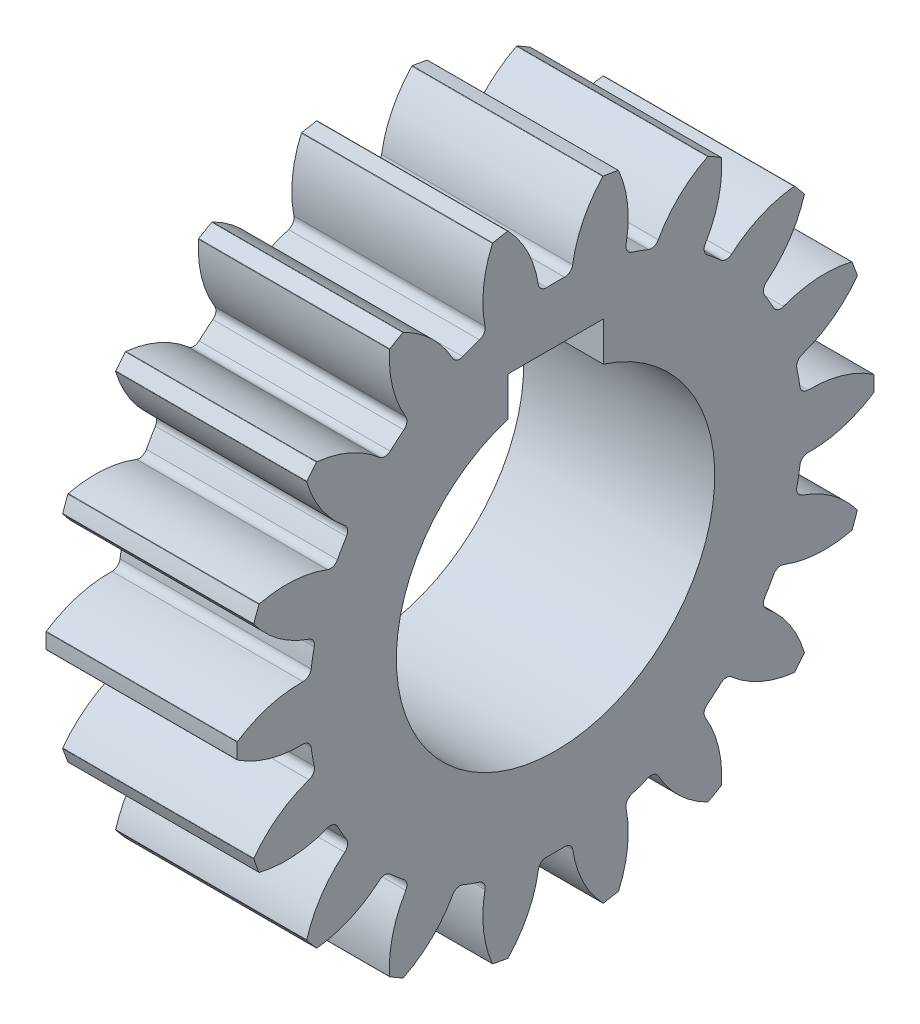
SolidWorks part; units mm, degrees
ref_plane "Plane1" through (0, 0, 0) normal (0, 0, 1) x (1, 0, 0)
ref_plane "Plane2" through (0, 0, 0) normal (0, 1, 0) x (1, 0, 0)
ref_plane "Plane3" through (0, 0, 0) normal (1, 0, 0) x (0, 0, -1)
sketch "HoldingSke" plane through (0, 0, 0) normal (0, 1, 0) x (1, 0, 0)
  line L0 (0, 0) -> (0.9511, -0.309)
  line L1 (-15, 0) -> (100, 0) construction
  line L2 (0, 0) -> (-2.1039, 2.3779)
  line L3 (0, 0) -> (-11.863, 4.5341)
  line L4 (0, 0) -> (8.2133, 2.6687)
  line L5 (0, 0) -> (-46.8476, -17.4728)
  line L6 (0, 0) -> (-4.9738, -3.3558)
  line L7 (-2.1039, 2.3779) -> (8.6586, 51.2059)
  line L8 (-76.2, 54.61) -> (-76.1, 54.61)
  line L9 (-71.009, 38.7566) -> (-53.1078, 45.2721)
  line L10 (-76.2, 71.12) -> (104.1128, 71.12)
  line L11 (0, 0) -> (-6, 0)
  line L12 (-76.2, 101.6) -> (-76.162, 101.6)
  line L13 (24.9733, 27.94) -> (52.9518, 28.4284)
  line L14 (24.9733, 27.94) -> (24.9743, 27.94)
  line L15 (24.9733, 27.94) -> (100.4006, 29.5858)
  line L16 (-63.627, -1) -> (-12.827, -1)
  circle A0 centre (0, 0) radius 0.4
  circle A1 centre (0, 0) radius 7.749
  circle A2 centre (0, 0) radius 37.5
  circle A3 centre (0, 0) radius 0.4
  dimension "MHD" = 15.498
  dimension "Hub_dia" = 75
  dimension "Bore" = 0.8
  dimension "MBD" = 0.8
  dimension "Num_teeth" = 18
  dimension "Pitch_radius" = 180.3128
  dimension "Pitch" = 1
  dimension "Width" = 6
  dimension "Overall_len" = 50
  dimension "Show_teeth" = 18
  dimension "Thickness" = 6
  dimension "OAL" = 50.0001
  dimension "T_dim" = 0.1
  dimension "Ap" = 20
  dimension "H" = 19.05
  dimension "Backlash" = 0.038
  dimension "Addendum_fac" = 1
  dimension "Dedendum_fac" = 1.25
  dimension "Clearance_fac" = 0.25
  dimension "Dedendum_add" = 0.001
  dimension "Module" = 1
sketch "BasProSke" plane through (0, 0, 0) normal (0, 1, 0) x (1, 0, 0)
  line L0 (-10, 0) -> (60, 0) construction
  line L1 (0, 0) -> (0, 10)
  line L2 (0, 0) -> (6, 0)
  line L3 (6, 0) -> (6, 10)
  line L4 (6, 10) -> (0, 10)
  dimension "Diameter" = 20
  dimension "Thickness" = 6
revolve "Base-Revolve" add sketch "BasProSke" angle 360 about L0
sketch "TooCutSke" plane through (0, 0, 0) normal (1, 0, 0) x (0, 0, -1)
  line L1 (0, 0) -> (0, 107) construction
  line L2 (0, 0) -> (-0.8509, 8.9597) construction
  line L3 (0, 0) -> (-3.1157, 17.6701) construction
  line L4 (-0.8509, 8.9597) -> (-1.5579, 8.835) construction
  arc A0 (0.5106, 7.7322) -> (-0.5106, 7.7322) centre (0, 0) ccw
  arc A1 (1.5152, 9.9102) -> (-1.5152, 9.9102) centre (0, 0) ccw
  circle A2 centre (0, 0) radius 9 construction
  circle A3 centre (0, 0) radius 8.4572 construction
  arc A4 (-0.5106, 7.7322) -> (-1.5152, 9.9102) centre (-4.0952, 7.3996) ccw
  arc A5 (1.5152, 9.9102) -> (0.5106, 7.7322) centre (4.0952, 7.3996) ccw
  dimension "Root_dia" = 15.498
  dimension "Overcut_dia" = 20.0508
  dimension "Pitch_dia" = 18
  dimension "Base_dia" = 16.9145
  dimension "Flank_rad" = 3.6
  dimension "Half_ang" = 10
  dimension "Half_CT" = 0.7179
extrude "ToothCut" cut sketch "TooCutSke" along normal through all
fillet "Breaks" radius 0.02 2 edges at (3, 9.8878, -1.4936) (3, 9.8878, 1.4936)
fillet "RootFillets" radius 0.251 2 edges at (3, 7.7322, -0.5106) (3, 7.7322, 0.5106)
pattern_circular "TeethCuts" count 18 every 20 about axis through (-10, 0, 0) along (1, 0, 0) of "ToothCut", "RootFillets", "Breaks"
sketch "HubNeaOneSke" plane through (0, 0, 0) normal (-1, 0, 0) x (0, 0, 1)
  circle A0 centre (0, 0) radius 7.749
  dimension "Diameter" = 15.498
extrude "HubNearOne" [suppressed] add sketch "HubNeaOneSke" along normal blind 44.0001
sketch "HubNeaBotSke" plane through (0, 0, 0) normal (-1, 0, 0) x (0, 0, 1)
  circle A0 centre (0, 0) radius 7.749
  dimension "Diameter" = 15.498
extrude "HubNearBoth" [suppressed] add sketch "HubNeaBotSke" along normal blind 22
ref_plane "FarPln" through (6, 0, 0) normal (1, 0, 0) x (0, 0, -1)
sketch "HubFarSke" plane through (6, 0, 0) normal (1, 0, 0) x (0, 0, -1)
  circle A0 centre (0, 0) radius 7.749
  dimension "Diameter" = 15.498
extrude "HubFar" [suppressed] add sketch "HubFarSke" along normal blind 22
sketch "BorSke" plane through (0, 0, 0) normal (1, 0, 0) x (0, 0, -1)
  circle A0 centre (0, 0) radius 0.4
  dimension "Diameter" = 0.8
extrude "Bore" cut sketch "BorSke" along normal mid plane 100.0001
sketch "KeySke" plane through (0, 0, 0) normal (1, 0, 0) x (0, 0, -1)
  line L0 (-0.05, 0) -> (-0.05, 0.5)
  line L1 (-0.05, 0.5) -> (0.05, 0.5)
  line L2 (0.05, 0.5) -> (0.05, 0)
  line L3 (0, 0) -> (0, 34) construction
  line L4 (-0.05, 0) -> (0.05, 0)
  dimension "Offset" = 0.5
  dimension "Width" = 0.1
extrude "Keyway" [suppressed] cut sketch "KeySke" along normal mid plane 100.0001
pattern_circular "Keyway2" [suppressed] count 2 every 90 about axis through (-10, 0, 0) along (1, 0, 0)
sketch "草图2" plane through (0, 0, 0) normal (-1, 0, 0) x (0, 0, 1)
  line L0 (1.5, 6) -> (-1.5, 6)
  line L1 (-1.5, 4.7697) -> (-1.5, 6)
  line L2 (1.5, 6) -> (1.5, 4.7697)
  arc A0 (-1.5, 4.7697) -> (1.5, 4.7697) centre (0, 0) ccw
extrude "切除-拉伸1" cut sketch "草图2" against normal through all
equation "' \"Module@HoldingSke\" = 6.35"
equation "' \"Num_teeth@HoldingSke\" = 12"
equation "' \"Ap@HoldingSke\" =  20"
equation "' \"Width@HoldingSke\" = 0.5 * 25.4"
equation "' \"Hub_dia@HoldingSke\"= 1 * 25.4"
equation "' \"Overall_len@HoldingSke\" = 1.0 * 25.4"
equation "' \"Bore@HoldingSke\" = 0.75 * 25.4"
equation "' \"T_dim@HoldingSke\" = 0.1 * 25.4"
equation "' \"Width@KeySke\" = 0.25 * 25.4"
equation "' \"Show_teeth@HoldingSke\" = 13"
equation "' \"Backlash@HoldingSke\" = 0.009 * 25.4"
equation "' \"Addendum_fac@HoldingSke\" = 1.0"
equation "' \"Dedendum_fac@HoldingSke\" = 1.25"
equation "' \"Dedendum_add@HoldingSke\" = 0.00005 * 25.4"
equation "' \"Clearance_fac@HoldingSke\" = 0.25"
equation "\"Pitch@HoldingSke\" = 1 / \"Module@HoldingSke\""
equation "\"Overcut_dia@TooCutSke\" = (\"Num_teeth@HoldingSke\" + 2 * \"Addendum_fac@HoldingSke\") / \"Pitch@HoldingSke\" + 0.002 * 25.4"
equation "\"Pitch_dia@TooCutSke\" = \"Num_teeth@HoldingSke\" / \"Pitch@HoldingSke\""
equation "\"Base_dia@TooCutSke\" = \"Num_teeth@HoldingSke\" / \"Pitch@HoldingSke\" * cos((\"Ap@HoldingSke\"  * 3.14159265 / 180))"
equation "\"Root_dia@TooCutSke\" = (\"Num_teeth@HoldingSke\" + 2) / \"Pitch@HoldingSke\" - 2 * (\"Addendum_fac@HoldingSke\" + \"Dedendum_fac@HoldingSke\") / \"Pitch@HoldingSke\" - \"Dedendum_add@HoldingSke\" * 2"
equation "\"Half_ang@TooCutSke\" = 180 / \"Num_teeth@HoldingSke\""
equation "\"Half_CT@TooCutSke\" = \"Num_teeth@HoldingSke\" / \"Pitch@HoldingSke\" * sin((3.14159265 / 2 / \"Num_teeth@HoldingSke\")) / 2 - 7 * \"Backlash@HoldingSke\" / 4"
equation "\"Flank_rad@TooCutSke\" = \"Num_teeth@HoldingSke\" / \"Pitch@HoldingSke\" / 5"
equation "\"Radius@RootFillets\" = \"Clearance_fac@HoldingSke\" / \"Pitch@HoldingSke\" + \"Dedendum_add@HoldingSke\""
equation "\"Break_rad@Breaks\" = 0.02 / \"Pitch@HoldingSke\""
equation "\"Thickness@HoldingSke\" = \"Width@HoldingSke\""
equation "\"OAL@HoldingSke\" = \"Thickness@HoldingSke\""
equation "\"MHD@HoldingSke\" = (\"Num_teeth@HoldingSke\" + 2) / \"Pitch@HoldingSke\" - 2 * (\"Addendum_fac@HoldingSke\" + \"Dedendum_fac@HoldingSke\")  / \"Pitch@HoldingSke\" - \"Dedendum_add@HoldingSke\" * 2"
equation "\"MBD@HoldingSke\" = (\"Num_teeth@HoldingSke\" + 2) / \"Pitch@HoldingSke\" - 2 * (\"Addendum_fac@HoldingSke\" + \"Dedendum_fac@HoldingSke\")  / \"Pitch@HoldingSke\" - \"Dedendum_add@HoldingSke\" * 2 - 0.002 * 25.4"
equation "\"MHD@HoldingSke\" = ((sgn( \"MHD@HoldingSke\" - \"Hub_dia@HoldingSke\" )-1)*( \"MHD@HoldingSke\" - \"Hub_dia@HoldingSke\" ))/-2+ \"Hub_dia@HoldingSke\""
equation "\"MBD@HoldingSke\" = ((sgn( \"MBD@HoldingSke\" - \"Bore@HoldingSke\" )-1)*( \"MBD@HoldingSke\" - \"Bore@HoldingSke\" ))/-2+ \"Bore@HoldingSke\""
equation "\"OAL@HoldingSke\" = ((sgn( \"OAL@HoldingSke\" - \"Overall_len@HoldingSke\" )+1)*( \"OAL@HoldingSke\" - \"Overall_len@HoldingSke\" ))/2 + \"Overall_len@HoldingSke\" + 0.000002 * 25.4"
equation "\"Num_teeth@TeethCuts\" = int( \"Show_teeth@HoldingSke\" ) + 1"
equation "\"Num_teeth@TeethCuts\" = ((sgn( \"Num_teeth@TeethCuts\" - \"Num_teeth@HoldingSke\" )-1)*( \"Num_teeth@TeethCuts\" - \"Num_teeth@HoldingSke\" ))/-2+ \"Num_teeth@HoldingSke\""
equation "\"Num_teeth@TeethCuts\" = ((sgn( \"Num_teeth@TeethCuts\" - 2.0)+1)*( \"Num_teeth@TeethCuts\" - 2.0))/2 +2.0"
equation "\"Angle@TeethCuts\" = 360.0 / \"Num_teeth@HoldingSke\""
equation "\"Diameter@BasProSke\" = (\"Num_teeth@HoldingSke\" + 2 * \"Addendum_fac@HoldingSke\") / \"Pitch@HoldingSke\""
equation "\"Thickness@BasProSke\"  = \"Thickness@HoldingSke\""
equation "' \"Fillet_rad@BasProSke\" =  \"Thickness@HoldingSke\" * 0.05"
equation "\"MHD@HoldingSke\" = ((sgn( \"MHD@HoldingSke\" - \"Root_dia@TooCutSke\" )-1)*( \"MHD@HoldingSke\" - \"Root_dia@TooCutSke\" ))/-2+ \"Root_dia@TooCutSke\""
equation "\"Diameter@HubNeaOneSke\" = \"MHD@HoldingSke\""
equation "\"Length@HubNearOne\" = \"OAL@HoldingSke\" - \"Thickness@BasProSke\""
equation "\"Diameter@HubNeaBotSke\" = \"MHD@HoldingSke\""
equation "\"Length@HubNearBoth\" = ( \"OAL@HoldingSke\" - \"Thickness@BasProSke\" ) / 2.0"
equation "\"Thickness@FarPln\" = \"Thickness@BasProSke\""
equation "\"Diameter@HubFarSke\" = \"MHD@HoldingSke\""
equation "\"Length@HubFar\" = ( \"OAL@HoldingSke\" - \"Thickness@BasProSke\" ) / 2.0"
equation "\"Diameter@BorSke\" = \"MBD@HoldingSke\""
equation "\"D1@Bore\" = \"OAL@HoldingSke\" * 2.0"
equation "\"D1@Keyway\" = \"OAL@HoldingSke\" * 2.0"
equation "\"Offset@KeySke\" = \"T_dim@HoldingSke\" + \"MBD@HoldingSke\" / 2.0"
